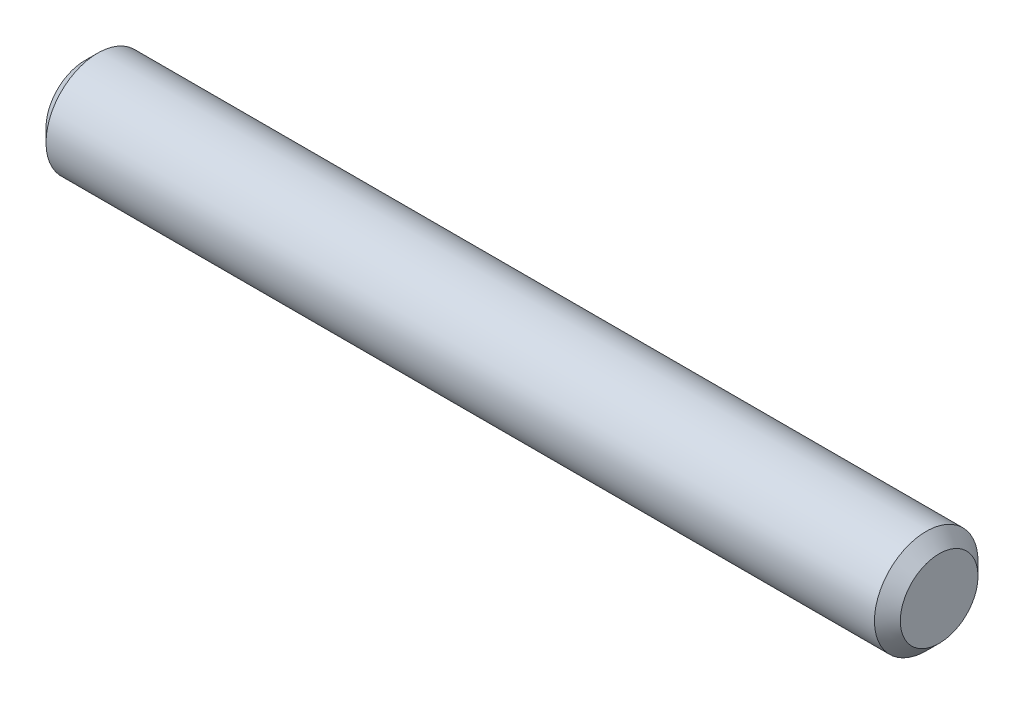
SolidWorks part; units mm, degrees
ref_plane "Plane1" through (0, 0, 0) normal (0, 0, 1) x (1, 0, 0)
ref_plane "Plane2" through (0, 0, 0) normal (0, 1, 0) x (1, 0, 0)
ref_plane "Plane3" through (0, 0, 0) normal (1, 0, 0) x (0, 0, -1)
sketch "Esquisse1" plane through (0, 0, 0) normal (0, 0, 1) x (1, 0, 0)
  line L0 (0, 0) -> (0, 3)
  line L1 (0, 3) -> (1, 4)
  line L2 (1, 4) -> (65, 4)
  line L3 (65, 4) -> (66, 3)
  line L4 (66, 3) -> (66, 0)
  line L5 (66, 0) -> (0, 0)
  line L6 (-3, 0) -> (73, 0) construction
  dimension "D1" = 4
revolve "Base-Révolution" add sketch "Esquisse1" angle 360 about L6
